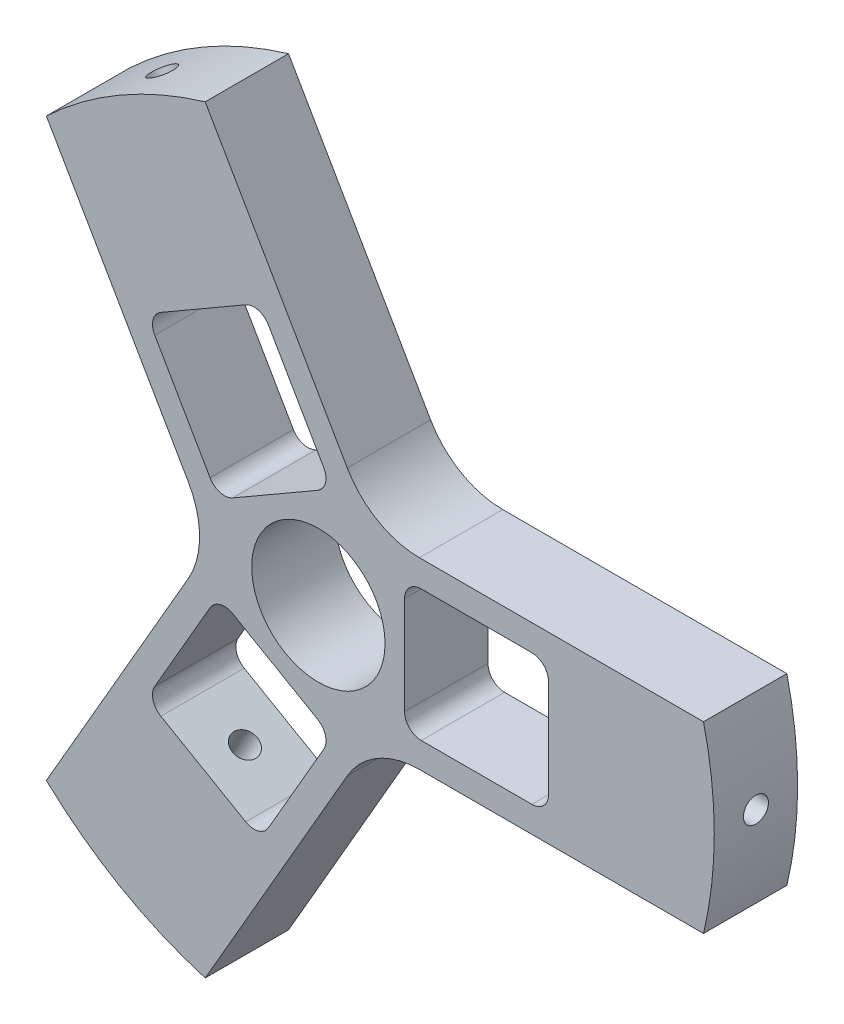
SolidWorks part; units mm, degrees
ref_plane "Plan de face" through (0, 0, 0) normal (0, 0, 1) x (1, 0, 0)
ref_plane "Plan de dessus" through (0, 0, 0) normal (0, 1, 0) x (1, 0, 0)
ref_plane "Plan de droite" through (0, 0, 0) normal (1, 0, 0) x (0, 0, -1)
sketch "Esquisse1" plane through (0, 0, 0) normal (0, 0, 1) x (1, 0, 0)
  line L0 (0, 11) -> (46.2088, 11)
  line L1 (0, -11) -> (46.2088, -11)
  arc A0 (46.2088, -11) -> (46.2088, 11) centre (0, 0) ccw
  arc A1 (0, 11) -> (0, -11) centre (0, 0) ccw
  circle A2 centre (0, 0) radius 8
  dimension "D1" = 16
  dimension "D2" = 95
  dimension "D3" = 3
extrude "Boss.-Extru.1" add sketch "Esquisse1" along normal blind 10
pattern_circular "Répétition circulaire1" count 3 over 360 about axis through (0, 0, 0) along (0, 0, 1) of "Boss.-Extru.1"
ref_plane "Plan1" through (20, 0, 0) normal (1, 0, 0) x (0, 0, -1)
sketch "Esquisse2" plane through (20, 0, 0) normal (1, 0, 0) x (0, 0, -1)
  line L0 (-10, 11) -> (0, -11) construction
  circle A0 centre (-5, 0) radius 1.5
  dimension "D1" = 3
extrude "Enlèv. mat.-Extru.1" cut sketch "Esquisse2" along normal through all
fillet "Congé1" radius 10 3 edges at (6.3509, 11, 5) (-12.7017, 0, 5) (6.3509, -11, 5)
sketch "Esquisse3" plane through (0, 0, 10) normal (0, 0, 1) x (1, 0, 0)
  line L0 (0, 0) -> (47.5, 0) construction
  line L1 (12.3463, 7.8766) -> (25.6193, 7.8766)
  line L2 (10.3463, 5.8766) -> (10.3463, -5.8766)
  line L3 (12.3463, -7.8766) -> (25.6193, -7.8766)
  line L4 (27.6193, 5.8766) -> (27.6193, -5.8766)
  arc A0 (46.2088, -11) -> (46.2088, 11) centre (0, 0) ccw construction
  arc A1 (10.3463, -5.8766) -> (12.3463, -7.8766) centre (12.3463, -5.8766) ccw
  arc A2 (25.6193, -7.8766) -> (27.6193, -5.8766) centre (25.6193, -5.8766) ccw
  arc A3 (25.6193, 7.8766) -> (27.6193, 5.8766) centre (25.6193, 5.8766) cw
  arc A4 (12.3463, 7.8766) -> (10.3463, 5.8766) centre (12.3463, 5.8766) ccw
  dimension "D1" = 2
extrude "Enlèv. mat.-Extru.2" cut sketch "Esquisse3" against normal through all
pattern_circular "Répétition circulaire2" count 3 over 360 about axis through (0, 0, 0) along (0, 0, 1) of "Enlèv. mat.-Extru.2", "Enlèv. mat.-Extru.1"
